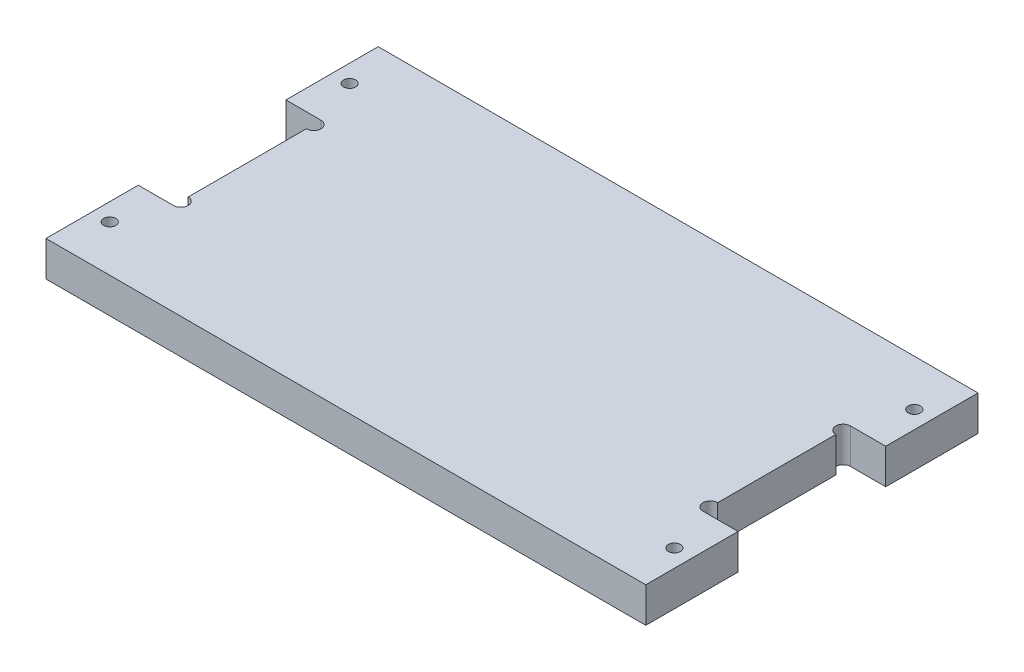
SolidWorks part; units mm, degrees
ref_plane "Front" through (0, 0, 0) normal (0, 0, 1) x (1, 0, 0)
ref_plane "Top" through (0, 0, 0) normal (0, 1, 0) x (1, 0, 0)
ref_plane "Right" through (0, 0, 0) normal (1, 0, 0) x (0, 0, -1)
sketch "Sketch1" plane through (0, 0, 0) normal (0, 1, 0) x (1, 0, 0)
  line L1 (0, 0) -> (325, 0)
  line L2 (0, 0) -> (0, 180)
  line L3 (0, 180) -> (325, 180)
  line L4 (325, 0) -> (325, 180)
  dimension "D1" = 180
  dimension "D2" = 325
extrude "Boss-Extrude1" add sketch "Sketch1" along normal blind 19.05
sketch "Sketch2" plane through (0, 19.05, 0) normal (0, 1, 0) x (1, 0, 0)
  line L0 (0, 0) -> (325, 0) construction
  line L1 (325, 90) -> (162.5, 90) construction
  line L2 (325, 0) -> (325, 180) construction
  line L3 (19.05, 58) -> (19.05, 122)
  line L4 (325, 50) -> (305.95, 50)
  line L5 (162.5, 180) -> (162.5, 0) construction
  line L6 (325, 180) -> (0, 180) construction
  line L7 (325, 50) -> (325, 130)
  line L8 (325, 130) -> (305.95, 130)
  line L9 (305.95, 58) -> (305.95, 122)
  line L10 (0, 130) -> (19.05, 130)
  line L11 (0, 50) -> (0, 130)
  line L12 (0, 50) -> (19.05, 50)
  arc A0 (305.95, 50) -> (305.95, 58) centre (305.95, 54) cw
  arc A1 (305.95, 130) -> (305.95, 122) centre (305.95, 126) ccw
  arc A2 (19.05, 130) -> (19.05, 122) centre (19.05, 126) cw
  arc A3 (19.05, 50) -> (19.05, 58) centre (19.05, 54) ccw
  dimension "D3" = 4
  dimension "D1" = 50
  dimension "D2" = 19.05
extrude "end joinery" cut sketch "Sketch2" against normal through all
hole_wizard "CBORE for M6 SHCS1" positions "Sketch4" profile "Sketch3" counterbore size "M6" standard "ANSI Metric"
sketch "Sketch4" plane through (0, 0, 0) normal (0, -1, 0) x (-1, 0, 0)
  line L0 (-325, 130) -> (-325, 180) construction
  line L1 (-325, 180) -> (0, 180) construction
  line L2 (-305.95, 90) -> (-19.05, 90) construction
  line L3 (-305.95, 122) -> (-305.95, 58) construction
  line L5 (-19.05, 58) -> (-19.05, 122) construction
  line L6 (-162.5, 90) -> (-162.5, 180) construction
  line L7 (-325, 180) -> (0, 180) construction
  point P0 (-315.475, 25)
  point P2 (-315.475, 155)
  point P26 (-9.525, 25)
  point P27 (-9.525, 155)
  dimension "D1" = 9.525
  dimension "D2" = 25
sketch "Sketch3" plane through (315.475, 0, -25) normal (1, 0, 0) x (0, 0, -1)
  line L0 (0, 0) -> (0, 19.05)
  line L1 (0, 19.05) -> (3.3, 19.05)
  line L3 (3.3, 19.05) -> (3.3, 6)
  line L4 (3.3, 6) -> (5.5, 6)
  line L5 (5.5, 6) -> (5.5, 0)
  line L7 (5.5, 0) -> (0, 0)
  line L11 (0, -6.35) -> (0, 107.95) construction
  dimension "Thru Hole Dia." = 6.6
  dimension "Thru Hole Depth" = 19.05
  dimension "C'Bore Dia." = 11
  dimension "C'Bore Depth" = 6
sketch "CAM tabs" plane through (0, 19.05, 0) normal (0, 1, 0) x (1, 0, 0)
  line L0 (19.05, 80.9757) -> (19.05, 58)
  line L1 (305.95, 82.8456) -> (305.95, 97.8456) construction
  line L2 (19.05, 58) -> (19.05, 122) construction
  line L3 (305.95, 97.8456) -> (305.95, 122)
  line L4 (305.95, 122) -> (305.95, 58) construction
  line L12 (19.05, 50) -> (0, 50)
  line L13 (0, 50) -> (0, 0)
  line L14 (0, 0) -> (325, 0)
  line L15 (325, 0) -> (325, 50)
  line L16 (325, 50) -> (305.95, 50)
  line L17 (305.95, 58) -> (305.95, 122)
  line L18 (305.95, 130) -> (325, 130)
  line L19 (325, 130) -> (325, 180)
  line L20 (325, 180) -> (0, 180)
  line L21 (0, 180) -> (0, 130)
  line L22 (0, 130) -> (19.05, 130)
  line L23 (19.05, 122) -> (19.05, 58)
  line L24 (19.05, 50) -> (0, 50)
  line L25 (0, 50) -> (0, 0)
  line L26 (0, 0) -> (325, 0)
  line L27 (325, 0) -> (325, 50)
  line L28 (325, 50) -> (305.95, 50)
  line L29 (305.95, 58) -> (305.95, 82.8456)
  line L30 (305.95, 130) -> (325, 130)
  line L31 (325, 130) -> (325, 180)
  line L32 (325, 180) -> (0, 180)
  line L33 (0, 180) -> (0, 130)
  line L34 (0, 130) -> (19.05, 130)
  line L35 (19.05, 122) -> (19.05, 95.9757)
  arc A4 (19.05, 50) -> (19.05, 58) centre (19.05, 54) ccw
  arc A5 (305.95, 58) -> (305.95, 50) centre (305.95, 54) ccw
  arc A6 (305.95, 130) -> (305.95, 122) centre (305.95, 126) ccw
  arc A7 (19.05, 122) -> (19.05, 130) centre (19.05, 126) ccw
  arc A8 (19.05, 50) -> (19.05, 58) centre (19.05, 54) ccw
  arc A9 (305.95, 58) -> (305.95, 50) centre (305.95, 54) ccw
  arc A10 (305.95, 130) -> (305.95, 122) centre (305.95, 126) ccw
  arc A11 (19.05, 122) -> (19.05, 130) centre (19.05, 126) ccw
  dimension "D2" = 15
  dimension "D3" = 15
  dimension "D1" = 0
